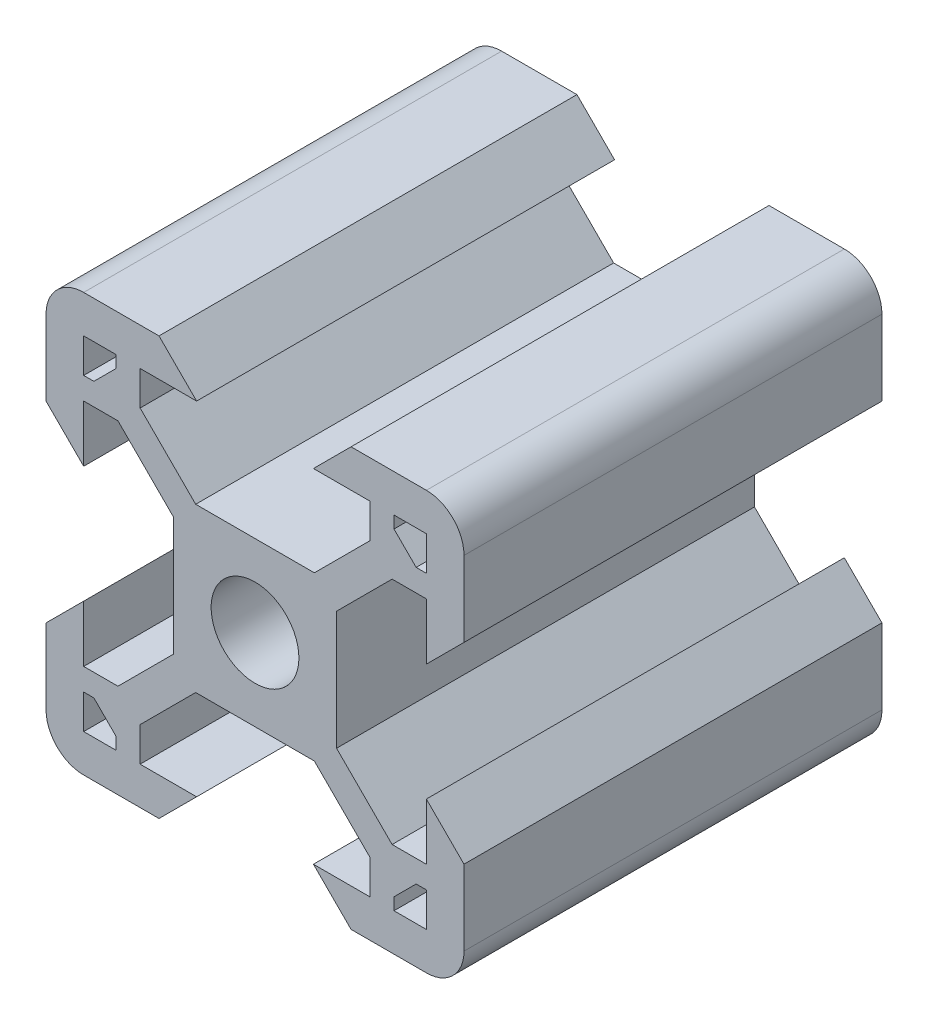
SolidWorks part; units mm, degrees
ref_plane "Front Plane" through (0, 0, 0) normal (0, 0, 1) x (1, 0, 0)
ref_plane "Top Plane" through (0, 0, 0) normal (0, 1, 0) x (1, 0, 0)
ref_plane "Right Plane" through (0, 0, 0) normal (1, 0, 0) x (0, 0, -1)
imported_body "Imported1"
sketch "Sketch2" plane through (0, 0, 25.4) normal (0, 0, 1) x (1, 0, 0)
  line L44 (-5.4993, -8.2) -> (-5.4993, -6.56)
  line L45 (-5.4993, -6.56) -> (-2.84, -3.9007)
  line L46 (-2.84, -3.9007) -> (2.84, -3.9007)
  line L47 (2.84, -3.9007) -> (5.4993, -6.56)
  line L48 (5.4993, -6.56) -> (5.4993, -8.2)
  line L49 (5.4993, -8.2) -> (2.7951, -8.2)
  line L50 (2.7951, -8.2) -> (4.5951, -10)
  line L51 (4.5951, -10) -> (8.2, -10)
  line L52 (10, -8.2) -> (10, -4.5951)
  line L53 (10, -4.5951) -> (8.2, -2.7951)
  line L54 (8.2, -2.7951) -> (8.2, -5.4993)
  line L55 (8.2, -5.4993) -> (6.56, -5.4993)
  line L56 (6.56, -5.4993) -> (3.9007, -2.84)
  line L57 (3.9007, -2.84) -> (3.9007, 2.84)
  line L58 (3.9007, 2.84) -> (6.56, 5.4993)
  line L59 (6.56, 5.4993) -> (8.2, 5.4993)
  line L60 (8.2, 5.4993) -> (8.2, 2.7951)
  line L61 (8.2, 2.7951) -> (10, 4.5951)
  line L62 (10, 4.5951) -> (10, 8.2)
  line L63 (8.2, 10) -> (4.5951, 10)
  line L64 (4.5951, 10) -> (2.7951, 8.2)
  line L65 (2.7951, 8.2) -> (5.4993, 8.2)
  line L66 (5.4993, 8.2) -> (5.4993, 6.56)
  line L67 (5.4993, 6.56) -> (2.84, 3.9007)
  line L68 (2.84, 3.9007) -> (-2.84, 3.9007)
  line L69 (-2.84, 3.9007) -> (-5.4993, 6.56)
  line L70 (-5.4993, 6.56) -> (-5.4993, 8.2)
  line L71 (-5.4993, 8.2) -> (-2.7951, 8.2)
  line L72 (-2.7951, 8.2) -> (-4.5951, 10)
  line L73 (-4.5951, 10) -> (-8.2, 10)
  line L74 (-10, 8.2) -> (-10, 4.5951)
  line L75 (-10, 4.5951) -> (-8.2, 2.7951)
  line L76 (-8.2, 2.7951) -> (-8.2, 5.4993)
  line L77 (-8.2, 5.4993) -> (-6.56, 5.4993)
  line L78 (-6.56, 5.4993) -> (-3.9007, 2.84)
  line L79 (-3.9007, 2.84) -> (-3.9007, -2.84)
  line L80 (-3.9007, -2.84) -> (-6.56, -5.4993)
  line L81 (-6.56, -5.4993) -> (-8.2, -5.4993)
  line L82 (-8.2, -5.4993) -> (-8.2, -2.7951)
  line L83 (-8.2, -2.7951) -> (-10, -4.5951)
  line L84 (-10, -4.5951) -> (-10, -8.2)
  line L85 (-8.2, -10) -> (-4.5951, -10)
  line L86 (-4.5951, -10) -> (-2.7951, -8.2)
  line L87 (-2.7951, -8.2) -> (-5.4993, -8.2)
  line L88 (-5.4993, -8.2) -> (-5.4993, -6.56)
  line L89 (-5.4993, -6.56) -> (-2.84, -3.9007)
  line L90 (-2.84, -3.9007) -> (2.84, -3.9007)
  line L91 (2.84, -3.9007) -> (5.4993, -6.56)
  line L92 (5.4993, -6.56) -> (5.4993, -8.2)
  line L93 (5.4993, -8.2) -> (2.7951, -8.2)
  line L94 (2.7951, -8.2) -> (4.5951, -10)
  line L95 (4.5951, -10) -> (8.2, -10)
  line L96 (10, -8.2) -> (10, -4.5951)
  line L97 (10, -4.5951) -> (8.2, -2.7951)
  line L98 (8.2, -2.7951) -> (8.2, -5.4993)
  line L99 (8.2, -5.4993) -> (6.56, -5.4993)
  line L100 (6.56, -5.4993) -> (3.9007, -2.84)
  line L101 (3.9007, -2.84) -> (3.9007, 2.84)
  line L102 (3.9007, 2.84) -> (6.56, 5.4993)
  line L103 (6.56, 5.4993) -> (8.2, 5.4993)
  line L104 (8.2, 5.4993) -> (8.2, 2.7951)
  line L105 (8.2, 2.7951) -> (10, 4.5951)
  line L106 (10, 4.5951) -> (10, 8.2)
  line L107 (8.2, 10) -> (4.5951, 10)
  line L108 (4.5951, 10) -> (2.7951, 8.2)
  line L109 (2.7951, 8.2) -> (5.4993, 8.2)
  line L110 (5.4993, 8.2) -> (5.4993, 6.56)
  line L111 (5.4993, 6.56) -> (2.84, 3.9007)
  line L112 (2.84, 3.9007) -> (-2.84, 3.9007)
  line L113 (-2.84, 3.9007) -> (-5.4993, 6.56)
  line L114 (-5.4993, 6.56) -> (-5.4993, 8.2)
  line L115 (-5.4993, 8.2) -> (-2.7951, 8.2)
  line L116 (-2.7951, 8.2) -> (-4.5951, 10)
  line L117 (-4.5951, 10) -> (-8.2, 10)
  line L118 (-10, 8.2) -> (-10, 4.5951)
  line L119 (-10, 4.5951) -> (-8.2, 2.7951)
  line L120 (-8.2, 2.7951) -> (-8.2, 5.4993)
  line L121 (-8.2, 5.4993) -> (-6.56, 5.4993)
  line L122 (-6.56, 5.4993) -> (-3.9007, 2.84)
  line L123 (-3.9007, 2.84) -> (-3.9007, -2.84)
  line L124 (-3.9007, -2.84) -> (-6.56, -5.4993)
  line L125 (-6.56, -5.4993) -> (-8.2, -5.4993)
  line L126 (-8.2, -5.4993) -> (-8.2, -2.7951)
  line L127 (-8.2, -2.7951) -> (-10, -4.5951)
  line L128 (-10, -4.5951) -> (-10, -8.2)
  line L129 (-8.2, -10) -> (-4.5951, -10)
  line L130 (-4.5951, -10) -> (-2.7951, -8.2)
  line L131 (-2.7951, -8.2) -> (-5.4993, -8.2)
  arc A4 (8.2, -10) -> (10, -8.2) centre (8.2, -8.2) ccw
  arc A5 (10, 8.2) -> (8.2, 10) centre (8.2, 8.2) ccw
  arc A6 (-8.2, 10) -> (-10, 8.2) centre (-8.2, 8.2) ccw
  arc A7 (-10, -8.2) -> (-8.2, -10) centre (-8.2, -8.2) ccw
  arc A8 (8.2, -10) -> (10, -8.2) centre (8.2, -8.2) ccw
  arc A9 (10, 8.2) -> (8.2, 10) centre (8.2, 8.2) ccw
  arc A10 (-8.2, 10) -> (-10, 8.2) centre (-8.2, 8.2) ccw
  arc A11 (-10, -8.2) -> (-8.2, -10) centre (-8.2, -8.2) ccw
  dimension "D1" = 0
extrude "Cut-Extrude1" cut sketch "Sketch2" against normal blind 5.3998
